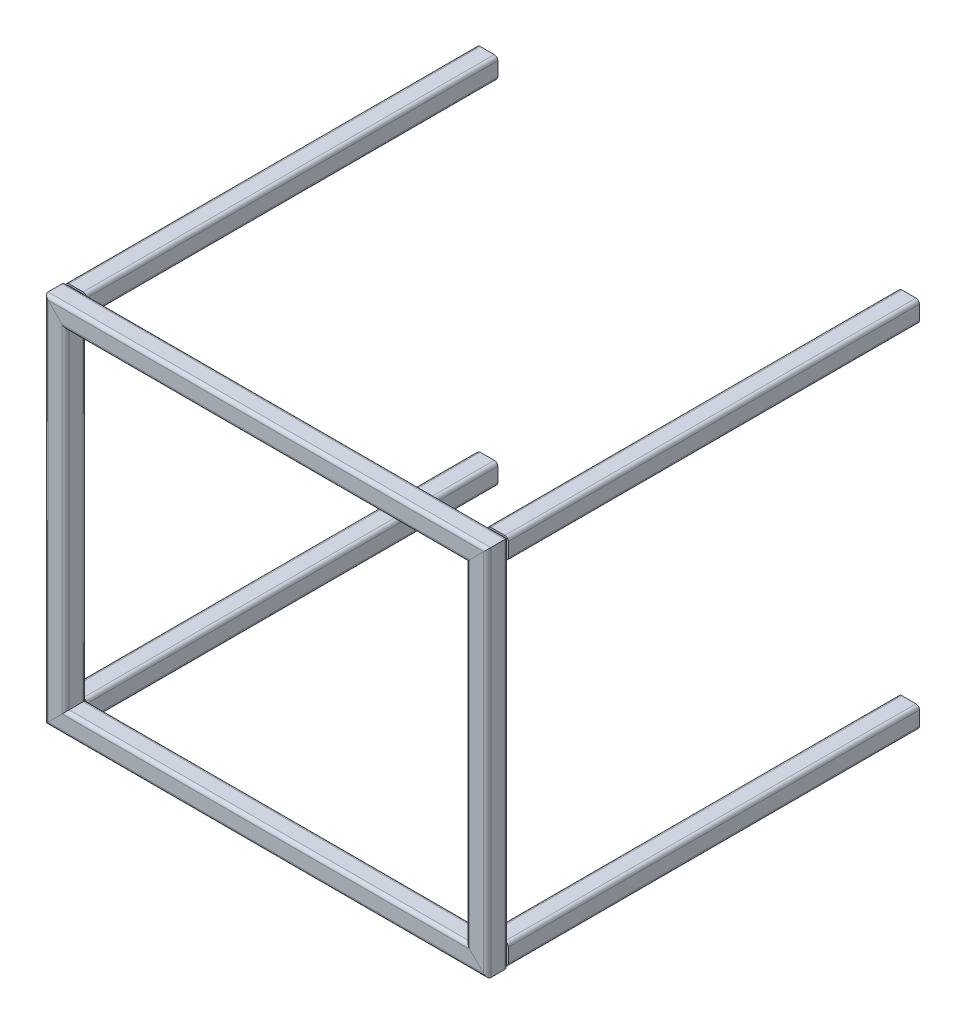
SolidWorks part; units mm, degrees
ref_plane "Front" through (0, 0, 0) normal (0, 0, 1) x (1, 0, 0)
ref_plane "Top" through (0, 0, 0) normal (0, 1, 0) x (1, 0, 0)
ref_plane "Right" through (0, 0, 0) normal (1, 0, 0) x (0, 0, -1)
sketch "Sketch1" plane through (0, 0, 0) normal (0, 0, 1) x (1, 0, 0)
  line L2 (-635, 762) -> (889, 762)
  line L3 (-635, 762) -> (-635, -508)
  line L4 (-635, -508) -> (889, -508)
  line L5 (889, 762) -> (889, -508)
  dimension "D1" = 1524
  dimension "D2" = 1270
  dimension "D3" = 635
  dimension "D4" = 762
ref_plane "Plane1" through (0, -508, 0) normal (0, 1, 0) x (-1, 0, 0)
sketch "Sketch2" plane through (0, -508, 0) normal (0, 1, 0) x (-1, 0, 0)
  line L0 (635, 0) -> (635, -1524)
  line L1 (-889, 0) -> (-889, -1524)
  dimension "D1" = 1524
ref_plane "Plane2" through (0, 762, 0) normal (0, 1, 0) x (-1, 0, 0)
sketch "Sketch3" plane through (0, 762, 0) normal (0, 1, 0) x (-1, 0, 0)
  line L0 (-889, 0) -> (-889, -1524)
  line L1 (635, 0) -> (635, -1524)
  line L2 (-889, 0) -> (-889, -1524) construction
  line L3 (635, 0) -> (635, -1524) construction
ref_plane "Plane3" through (-635, -508, 0) normal (0, 0, -1) x (-1, 0, 0)
other "Structural Member1"
ref_plane "Plane6" through (-635, 762, 0) normal (0, -1, 0) x (1, 0, 0)
sketch "Sketch13" plane through (-635, 762, 0) normal (0, -1, 0) x (1, 0, 0)
  line L0 (-25.4, -31.75) -> (25.4, -31.75)
  line L1 (-31.75, -25.4) -> (-31.75, 25.4)
  line L2 (25.4, 31.75) -> (-25.4, 31.75)
  line L3 (31.75, 25.4) -> (31.75, -25.4)
  line L4 (-25.4, -38.1) -> (25.4, -38.1)
  line L5 (-38.1, -25.4) -> (-38.1, 25.4)
  line L6 (25.4, 38.1) -> (-25.4, 38.1)
  line L7 (38.1, 25.4) -> (38.1, -25.4)
  line L8 (0, 0) -> (38.1, 0) construction
  line L9 (0, 0) -> (0, 38.1) construction
  arc A0 (38.1, 25.4) -> (25.4, 38.1) centre (25.4, 25.4) ccw
  arc A1 (25.4, -38.1) -> (38.1, -25.4) centre (25.4, -25.4) ccw
  arc A2 (-38.1, -25.4) -> (-25.4, -38.1) centre (-25.4, -25.4) ccw
  arc A3 (-25.4, 38.1) -> (-38.1, 25.4) centre (-25.4, 25.4) ccw
  arc A4 (-25.4, 31.75) -> (-31.75, 25.4) centre (-25.4, 25.4) ccw
  arc A5 (31.75, 25.4) -> (25.4, 31.75) centre (25.4, 25.4) ccw
  arc A6 (25.4, -31.75) -> (31.75, -25.4) centre (25.4, -25.4) ccw
  arc A7 (-31.75, -25.4) -> (-25.4, -31.75) centre (-25.4, -25.4) ccw
  point P3 (0, -38.1)
  point P5 (0, 0)
  point P33 (0, 0)
  point P36 (38.1, 0)
  point P37 (0, 38.1)
  dimension "D1" = 12.7
  dimension "Thickness" = 6.35
  dimension "V_leg" = 76.2
  dimension "H_leg" = 76.2
other "Structural Member2"
ref_plane "Plane7" through (-635, -508, 0) normal (0, 0, -1) x (-1, 0, 0)
sketch "Sketch14" plane through (-635, -508, 0) normal (0, 0, -1) x (-1, 0, 0)
  line L0 (-25.4, -31.75) -> (25.4, -31.75)
  line L1 (-31.75, -25.4) -> (-31.75, 25.4)
  line L2 (25.4, 31.75) -> (-25.4, 31.75)
  line L3 (31.75, 25.4) -> (31.75, -25.4)
  line L4 (-25.4, -38.1) -> (25.4, -38.1)
  line L5 (-38.1, -25.4) -> (-38.1, 25.4)
  line L6 (25.4, 38.1) -> (-25.4, 38.1)
  line L7 (38.1, 25.4) -> (38.1, -25.4)
  line L8 (0, 0) -> (38.1, 0) construction
  line L9 (0, 0) -> (0, 38.1) construction
  arc A0 (38.1, 25.4) -> (25.4, 38.1) centre (25.4, 25.4) ccw
  arc A1 (25.4, -38.1) -> (38.1, -25.4) centre (25.4, -25.4) ccw
  arc A2 (-38.1, -25.4) -> (-25.4, -38.1) centre (-25.4, -25.4) ccw
  arc A3 (-25.4, 38.1) -> (-38.1, 25.4) centre (-25.4, 25.4) ccw
  arc A4 (-25.4, 31.75) -> (-31.75, 25.4) centre (-25.4, 25.4) ccw
  arc A5 (31.75, 25.4) -> (25.4, 31.75) centre (25.4, 25.4) ccw
  arc A6 (25.4, -31.75) -> (31.75, -25.4) centre (25.4, -25.4) ccw
  arc A7 (-31.75, -25.4) -> (-25.4, -31.75) centre (-25.4, -25.4) ccw
  point P3 (0, -38.1)
  point P4 (-38.1, 0)
  point P5 (0, 0)
  point P6 (38.1, -38.1)
  point P7 (-38.1, -38.1)
  point P8 (-38.1, 38.1)
  point P33 (0, 0)
  point P35 (38.1, 38.1)
  point P36 (38.1, 0)
  point P37 (0, 38.1)
  dimension "D1" = 12.7
  dimension "Thickness" = 6.35
  dimension "V_leg" = 76.2
  dimension "H_leg" = 76.2
other "Structural Member3"
ref_plane "Plane8" through (-635, 762, 0) normal (0, 0, -1) x (-1, 0, 0)
sketch "Sketch15" plane through (-635, 762, 0) normal (0, 0, -1) x (-1, 0, 0)
  line L0 (-25.4, -31.75) -> (25.4, -31.75)
  line L1 (-31.75, -25.4) -> (-31.75, 25.4)
  line L2 (25.4, 31.75) -> (-25.4, 31.75)
  line L3 (31.75, 25.4) -> (31.75, -25.4)
  line L4 (-25.4, -38.1) -> (25.4, -38.1)
  line L5 (-38.1, -25.4) -> (-38.1, 25.4)
  line L6 (25.4, 38.1) -> (-25.4, 38.1)
  line L7 (38.1, 25.4) -> (38.1, -25.4)
  line L8 (0, 0) -> (38.1, 0) construction
  line L9 (0, 0) -> (0, 38.1) construction
  arc A0 (38.1, 25.4) -> (25.4, 38.1) centre (25.4, 25.4) ccw
  arc A1 (25.4, -38.1) -> (38.1, -25.4) centre (25.4, -25.4) ccw
  arc A2 (-38.1, -25.4) -> (-25.4, -38.1) centre (-25.4, -25.4) ccw
  arc A3 (-25.4, 38.1) -> (-38.1, 25.4) centre (-25.4, 25.4) ccw
  arc A4 (-25.4, 31.75) -> (-31.75, 25.4) centre (-25.4, 25.4) ccw
  arc A5 (31.75, 25.4) -> (25.4, 31.75) centre (25.4, 25.4) ccw
  arc A6 (25.4, -31.75) -> (31.75, -25.4) centre (25.4, -25.4) ccw
  arc A7 (-31.75, -25.4) -> (-25.4, -31.75) centre (-25.4, -25.4) ccw
  point P3 (0, -38.1)
  point P4 (-38.1, 0)
  point P5 (0, 0)
  point P6 (38.1, -38.1)
  point P7 (-38.1, -38.1)
  point P8 (-38.1, 38.1)
  point P33 (0, 0)
  point P35 (38.1, 38.1)
  point P36 (38.1, 0)
  point P37 (0, 38.1)
  dimension "D1" = 12.7
  dimension "Thickness" = 6.35
  dimension "V_leg" = 76.2
  dimension "H_leg" = 76.2
other "Trim/Extend1"
other "Trim/Extend2"
other "Trim/Extend3"
other "Trim/Extend4"
equation "\"D3@Sketch1\" = \"D2@Sketch1\"/2"
equation "\"D4@Sketch1\" = \"D1@Sketch1\"/2"
